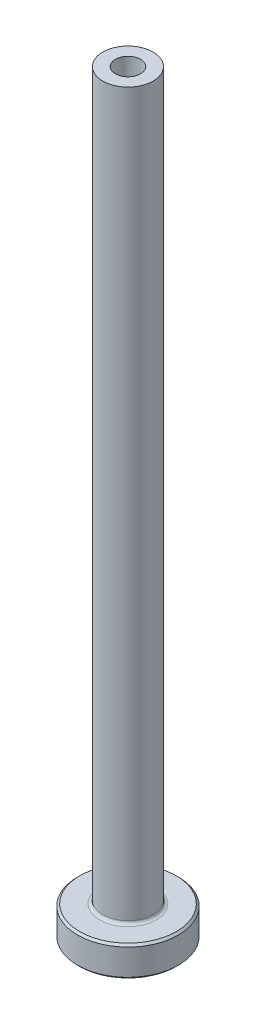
SolidWorks part; units mm, degrees
ref_plane "Front Plane" through (0, 0, 0) normal (0, 0, 1) x (1, 0, 0)
ref_plane "Top Plane" through (0, 0, 0) normal (0, 1, 0) x (1, 0, 0)
ref_plane "Right Plane" through (0, 0, 0) normal (1, 0, 0) x (0, 0, -1)
sketch "Sketch1" plane through (0, 0, 0) normal (0, 0, 1) x (1, 0, 0)
  line L0 (-1.25, 75) -> (-2.5, 75)
  line L1 (-2.5, 75) -> (-2.5, 3)
  line L2 (-2.5, 3) -> (-5, 3)
  line L3 (-5, 3) -> (-5, 0)
  line L4 (5.5, 0) -> (-5.5, 0) construction
  line L5 (-5, 0) -> (-1.5, 0)
  line L6 (-1.25, 40) -> (-1.25, 75)
  line L7 (0, 92.1877) -> (0, -15.5353) construction
  line L8 (0, -5.5) -> (0, 5.5) construction
  line L9 (-1.25, 40) -> (-1.5, 28)
  line L10 (-1.5, 28) -> (-1.5, 0)
  dimension "D1" = 0.25
  dimension "ID" = 2.5
  dimension "OD" = 5
  dimension "L" = 75
  dimension "H" = 10
  dimension "T" = 3
  dimension "N" = 35
  dimension "D2" = 12
revolve "Revolve1" add sketch "Sketch1" angle 360 about L7
fillet "Fillet1" radius 0.3 1 edges at (0, 3, 2.5)
chamfer "Chamfer1" distance 0.2 angle 45 2 edges at (0, 3, 5) (0, 0, 5)
chamfer "Chamfer3" distance 0.5 angle 45 1 edges at (0, 0, 1.5)
